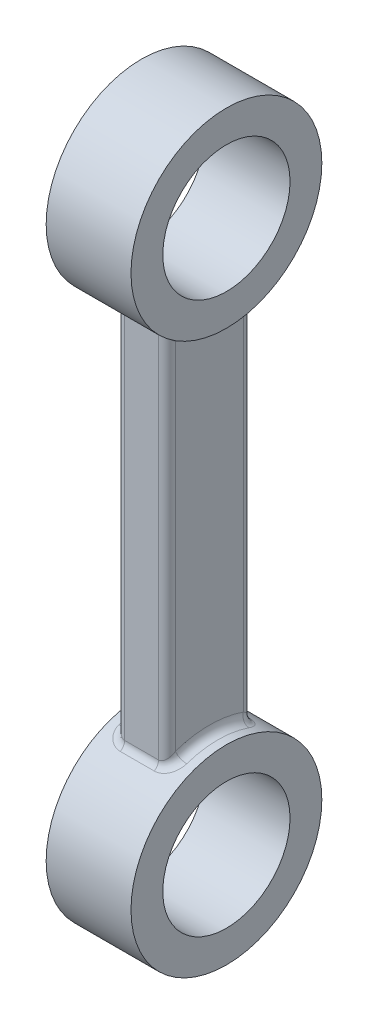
SolidWorks part; units mm, degrees
ref_plane "Front Plane" through (0, 0, 0) normal (0, 0, 1) x (1, 0, 0)
ref_plane "Top Plane" through (0, 0, 0) normal (0, 1, 0) x (1, 0, 0)
ref_plane "Right Plane" through (0, 0, 0) normal (1, 0, 0) x (0, 0, -1)
sketch "Sketch1" plane through (0, 0, 0) normal (1, 0, 0) x (0, 0, -1)
  circle A0 centre (0, 0) radius 15
  circle A1 centre (0, 0) radius 22.5
  dimension "D1" = 30
  dimension "D2" = 45
extrude "Boss-Extrude1" add sketch "Sketch1" along normal mid plane 20
sketch "Sketch2" plane through (0, 0, 0) normal (1, 0, 0) x (0, 0, -1)
  line L0 (0, 0) -> (0, 65.9908) construction
  line L3 (-10, 109.8444) -> (-10, 20.1556)
  line L5 (10, 109.8444) -> (10, 20.1556)
  circle A0 centre (0, 0) radius 22.5 construction
  arc A1 (10, 20.1556) -> (-10, 20.1556) centre (0, 0) ccw
  arc A2 (-10, 109.8444) -> (10, 109.8444) centre (0, 130) ccw
  dimension "D3" = 22.5
  dimension "D1" = 20
  dimension "D2" = 130
extrude "Boss-Extrude2" add sketch "Sketch2" along normal mid plane 12
sketch "Sketch3" plane through (0, 0, 0) normal (1, 0, 0) x (0, 0, -1)
  circle A0 centre (0, 130) radius 22.5
  arc A1 (-10, 109.8444) -> (10, 109.8444) centre (0, 130) ccw construction
  circle A2 centre (0, 130) radius 15
  dimension "D1" = 30
extrude "Boss-Extrude3" add sketch "Sketch3" along normal mid plane 20
fillet "Fillet1" radius 2 12 edges at (0, 20.1556, 10) (0, 109.8444, 10) (6, 22.5, 0) (-6, 22.5, 0) (6, 107.5, 0) (-6, 107.5, 0) (0, 20.1556, -10) (0, 109.8444, -10) (-6, 65, -10) (6, 65, -10) (-6, 65, 10) (6, 65, 10)
